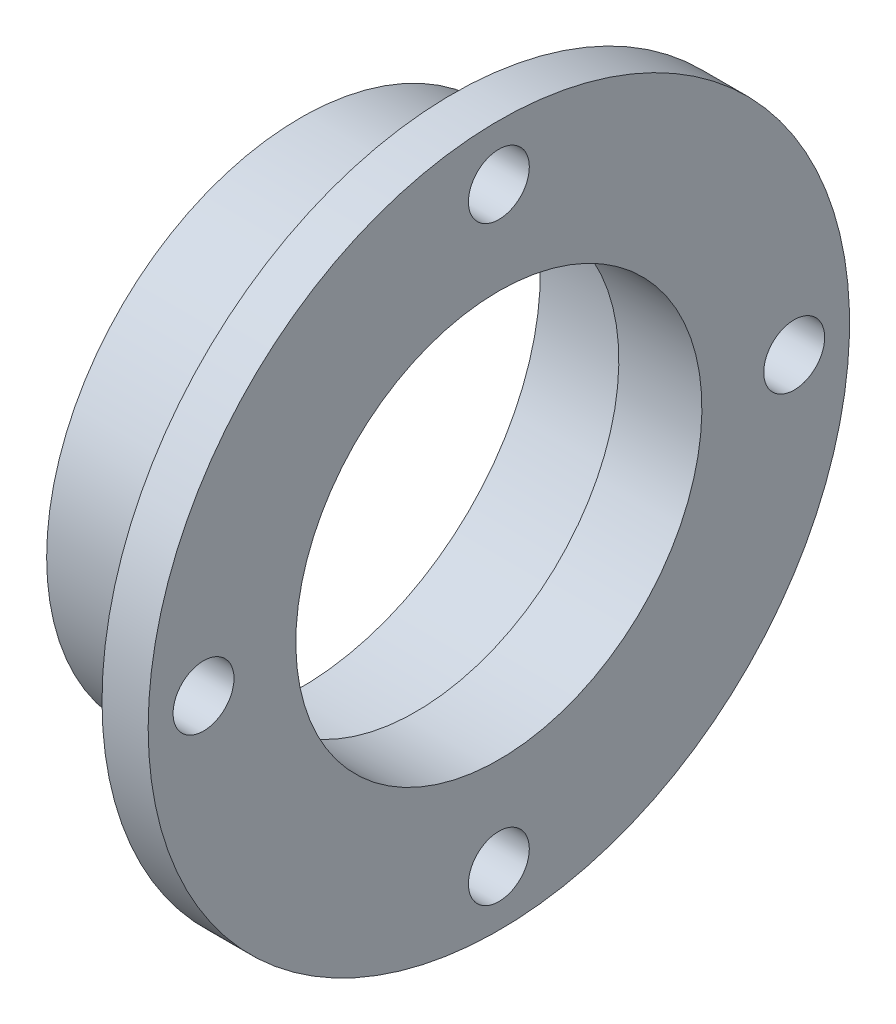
SolidWorks part; units mm, degrees
ref_plane "Face" through (0, 0, 0) normal (0, 0, 1) x (1, 0, 0)
ref_plane "Dessus" through (0, 0, 0) normal (0, 1, 0) x (1, 0, 0)
ref_plane "Droite" through (0, 0, 0) normal (1, 0, 0) x (0, 0, -1)
sketch "Esquisse1" plane through (0, 0, 0) normal (0, 0, 1) x (1, 0, 0)
  line L0 (0, 0) -> (0, 38)
  line L1 (0, 0) -> (52.37, 0) construction
  line L2 (0, 38) -> (-5, 38)
  line L3 (-5, 38) -> (-5, 27.5)
  line L4 (-5, 27.5) -> (-21.5, 27.5)
  line L5 (-21.5, 27.5) -> (-21.5, 0)
  line L6 (-21.5, 0) -> (0, 0)
  dimension "D1" = 38
  dimension "D2" = 5
  dimension "D3" = 27.5
  dimension "D4" = 16.5
revolve "Révolution1" add sketch "Esquisse1" angle 360 about L1
sketch "Esquisse2" plane through (0, 0, 0) normal (0, 0, 1) x (1, 0, 0)
  line L0 (0, 0) -> (-39.6427, 0) construction
  line L1 (0, 0) -> (0, 22)
  line L2 (0, -38) -> (0, 38) construction
  line L3 (0, 22) -> (-9, 22)
  line L4 (-9, 22) -> (-9, 26)
  line L5 (-9, 26) -> (-21.5, 26)
  line L6 (-21.5, 27.5) -> (-21.5, -27.5) construction
  line L7 (-21.5, 26) -> (-21.5, 0)
  line L8 (-21.5, 0) -> (0, 0)
  dimension "D1" = 22
  dimension "D2" = 26
  dimension "D3" = 9
revolve "Enlèvement de matière-Révolution1" cut sketch "Esquisse2" angle 360 about L0
hole_wizard "Dégagement M61" positions "Esquisse4" profile "Esquisse3" hole size "M6" standard "ISO"
sketch "Esquisse4" plane through (0, 0, 0) normal (1, 0, 0) x (0, 0, -1)
  point P0 (0, 32)
  dimension "D1" = 32
sketch "Esquisse3" plane through (0, 32, 0) normal (0, 1, 0) x (0, 0, -1)
  line L0 (0, 0) -> (0, 21.5)
  line L1 (0, 21.5) -> (3.3, 21.5)
  line L2 (3.3, 21.5) -> (3.3, 0)
  line L5 (3.3, 0) -> (0, 0)
  line L11 (0, -6.35) -> (0, 107.95) construction
  dimension "Diamètre du perçage jusqu'au prochain" = 6.6
  dimension "Profondeur du perçage jusqu'au prochain" = 21.5
pattern_circular "Répétition circulaire1" count 4 over 360 about axis through (0, 0, 0) along (1, 0, 0) of "Dégagement M61"
